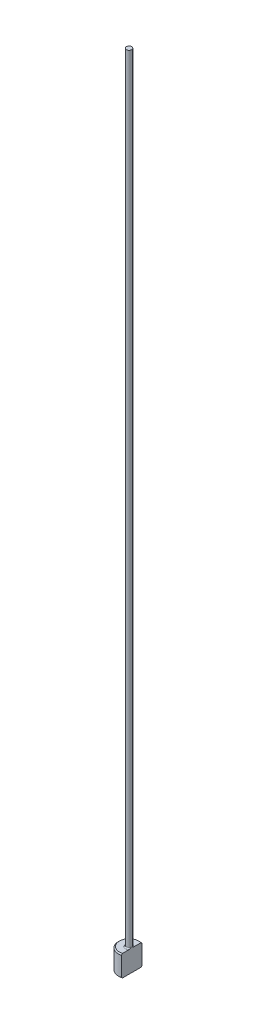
SolidWorks part; units mm, degrees
ref_plane "Front Plane" through (0, 0, 0) normal (0, 0, 1) x (1, 0, 0)
ref_plane "Top Plane" through (0, 0, 0) normal (0, 1, 0) x (1, 0, 0)
ref_plane "Right Plane" through (0, 0, 0) normal (1, 0, 0) x (0, 0, -1)
sketch "Sketch1" plane through (0, 0, 0) normal (0, 0, 1) x (1, 0, 0)
  line L0 (0, 259.9588) -> (0, -15.1925) construction
  line L1 (0, 0) -> (-2, 0)
  line L2 (-2, 0) -> (-2, 4)
  line L3 (-2, 4) -> (-0.5, 4)
  line L4 (-0.5, 4) -> (-0.5, 150)
  line L5 (-0.5, 150) -> (0, 150)
  line L6 (0, 150) -> (0, 0)
  dimension "L" = 150
  dimension "H" = 4
  dimension "T" = 4
  dimension "D" = 1
revolve "Revolve1" add sketch "Sketch1" angle 360 about L0
chamfer "Chamfer1" distance 0.2 angle 45 2 edges at (0, 4, 2) (0, 0, 2)
fillet "Fillet1" radius 0.2 1 edges at (0, 4, 0.5)
sketch "Sketch2" plane through (0, 0, 0) normal (0, 1, 0) x (1, 0, 0)
  line L0 (0.5, -1.9365) -> (0.5, 1.9365)
  circle A0 centre (0, 0) radius 2 construction
  arc A1 (0.5, -1.9365) -> (0.5, 1.9365) centre (0, 0) ccw
  circle A2 centre (0, 0) radius 0.5 construction
extrude "KEYED HEAD" cut sketch "Sketch2" along normal through all
